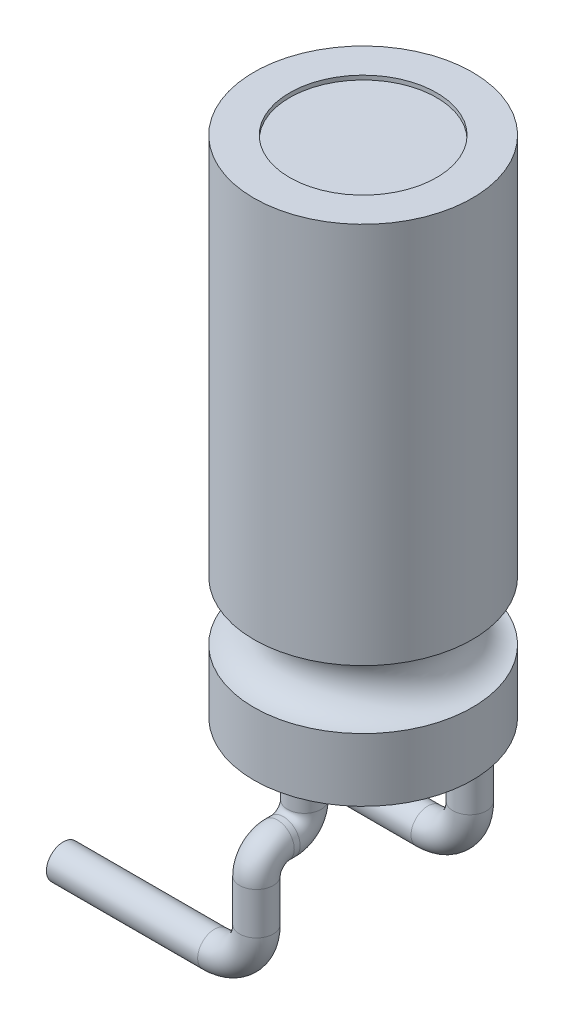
SolidWorks part; units mm, degrees
ref_plane "Face" through (0, 0, 0) normal (0, 0, 1) x (1, 0, 0)
ref_plane "Dessus" through (0, 0, 0) normal (0, 1, 0) x (1, 0, 0)
ref_plane "Droite" through (0, 0, 0) normal (1, 0, 0) x (0, 0, -1)
sketch "Esquisse1" plane through (0, 0, 0) normal (0, 0, 1) x (1, 0, 0)
  line L0 (0, 48.4017) -> (0, -33.7592) construction
  line L1 (0, 39.5164) -> (2.6, 39.5164)
  line L2 (2.6, 39.5164) -> (2.6, 30.4164)
  line L3 (2.6, 29.0164) -> (2.6, 27.5164)
  line L4 (2.6, 27.5164) -> (0, 27.5164)
  line L5 (0, 27.5164) -> (0, 39.5164)
  line L6 (9.8114, 29.7164) -> (-7.1309, 29.7164) construction
  line L7 (2.6, 25.0819) -> (2.6, 32.6721) construction
  line L8 (5.1241, 27.5164) -> (-5.6865, 27.5164) construction
  line L9 (5.1241, 29.0164) -> (-3.1767, 29.0164) construction
  arc A0 (2.6, 30.4164) -> (2.6, 29.0164) centre (2.6, 29.7164) ccw
  dimension "D4" = 0.7
  dimension "D1" = 12
  dimension "D2" = 2.6
  dimension "D3" = 1.5
revolve "Révolution1" add sketch "Esquisse1" angle 360 about L0
sketch "Esquisse2" plane through (0, 39.5164, 0) normal (0, 1, 0) x (-1, 0, 0)
  circle A0 centre (0, 0) radius 1.75
  dimension "D1" = 3.5
extrude "Enlèv. mat.-Extru.1" cut sketch "Esquisse2" against normal blind 0.1
sketch "Esquisse3" plane through (0, 27.5164, 0) normal (0, -1, 0) x (1, 0, 0)
  line L0 (4.0351, 0) -> (-4.283, 0) construction
  line L1 (0, 6.7464) -> (0, -6.9013) construction
  circle A0 centre (0, 1.4) radius 0.4
  dimension "D1" = 0.8
sketch "Esquisse4" plane through (0, 0, 0) normal (1, 0, 0) x (0, 0, -1)
  line L0 (-1.4, 24.8484) -> (-1.4, 29.3314) construction
  line L1 (-5.5325, 26.0164) -> (6.9013, 26.0164) construction
  line L2 (-2.54, 26.4376) -> (-2.54, 18.8472) construction
  line L3 (-8.7913, 27.5164) -> (10.5025, 27.5164) construction
  line L4 (0, 26.7733) -> (0, 22.2147) construction
  line L6 (-1.4, 27.5164) -> (-1.4, 26.5164)
  line L7 (-1.9, 26.0164) -> (-2.04, 26.0164)
  arc A0 (-1.4, 26.5164) -> (-1.9, 26.0164) centre (-1.9, 26.5164) cw
  arc A1 (-2.04, 26.0164) -> (-2.54, 25.5164) centre (-2.04, 25.5164) ccw
  dimension "D4" = 0.5
  dimension "D1" = 1.5
  dimension "D2" = 2.54
sweep "Balayage1" add profiles "Esquisse3" path "Esquisse4"
sketch "Esquisse5" plane through (0, 25.5164, 0) normal (0, -1, 0) x (1, 0, 0)
  line L0 (0, 2.8846) -> (0, 1.9) construction
  line L1 (0.1862, 2.54) -> (-0.4, 2.54) construction
  circle A0 centre (0, 2.54) radius 0.4
ref_plane "Plan1" through (0, 0, 2.54) normal (0, 0, 1) x (1, 0, 0)
sketch "Esquisse6" plane through (0, 0, 2.54) normal (0, 0, 1) x (1, 0, 0)
  line L0 (0, 25.7821) -> (0, 22.579) construction
  line L1 (1.0149, 23.5164) -> (-9.4986, 23.5164) construction
  line L2 (1.2934, 25.5164) -> (-9.4986, 25.5164) construction
  line L3 (-2.6, 27.2212) -> (-2.6, 21.8479) construction
  line L4 (-4.6, 21.8479) -> (-4.6, 27.2212) construction
  line L5 (0, 25.5164) -> (0, 24.5164)
  line L6 (-1, 23.5164) -> (-4.6, 23.5164)
  arc A0 (0, 24.5164) -> (-1, 23.5164) centre (-1, 24.5164) cw
  dimension "D3" = 1
  dimension "D1" = 2
  dimension "D2" = 2
sweep "Balayage2" add profiles "Esquisse5" path "Esquisse6"
ref_plane "Plan2" through (0, 0, 0) normal (0, 0, 1) x (1, 0, 0)
mirror "Symétrie1" about plane through (0, 0, 0) normal (0, 0, 1) of "Balayage2", "Balayage1"
